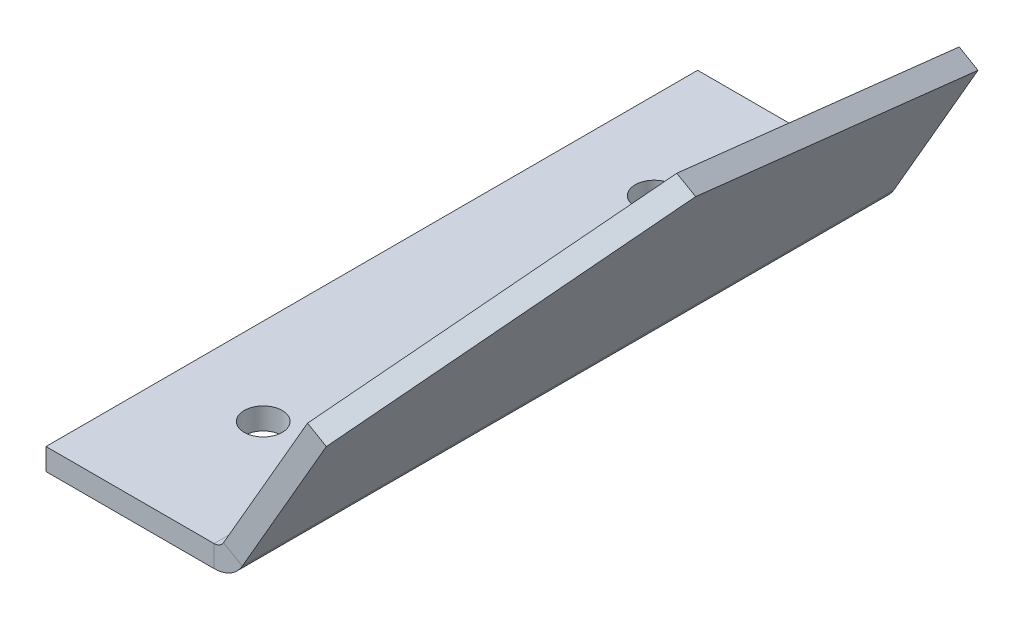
SolidWorks part; units mm, degrees
ref_plane "Front Plane" through (0, 0, 0) normal (0, 0, 1) x (1, 0, 0)
ref_plane "Top Plane" through (0, 0, 0) normal (0, 1, 0) x (1, 0, 0)
ref_plane "Right Plane" through (0, 0, 0) normal (1, 0, 0) x (0, 0, -1)
sketch "Sketch1" plane through (0, 0, 0) normal (0, 1, 0) x (1, 0, 0)
  line L0 (0, 0) -> (-40, 0) construction
  line L1 (-40, -30) -> (-40, 30)
  line L2 (-40, 30) -> (-8, 30)
  line L3 (-8, 30) -> (0, 0)
  line L4 (-40, -30) -> (-8, -30)
  line L5 (-8, -30) -> (0, 0)
  circle A0 centre (-32, 18) radius 1.75
  circle A1 centre (-32, -18) radius 1.75
  dimension "D4" = 8
  dimension "D5" = 18
  dimension "D6" = 3.5
  dimension "D1" = 8
  dimension "D2" = 32
  dimension "D3" = 30
sheet metal parameters "Sheet-Metal1" thickness 2 parameters "D1"=1
base flange "Base-Flange1" sketch "Sketch1" thickness 2 reverse thickness direction yes parameters "D1"=1
sketch "Sketch3" plane through (0, 2, 0) normal (0, 1, 0) x (1, 0, 0)
  line L0 (-24, 30) -> (-24, -30)
  line L1 (-8, 30) -> (-40, 30) construction
  line L2 (-40, -30) -> (-8, -30) construction
  line L3 (-40, 30) -> (-40, -30) construction
  dimension "D1" = 16
sketched bend "Sketched Bend1" parameters "D1"=1
bend "SketchBend1" bend radius 1 bend angle 60 parameters "D5"=1
flat pattern "Flat-Pattern1"
sketch "Bend-Lines1" plane through (0, 0, 0) normal (0, 1, 0) x (-1, 0, 0)
bend of the flat pattern "Flatten-<SketchBend1>1"
